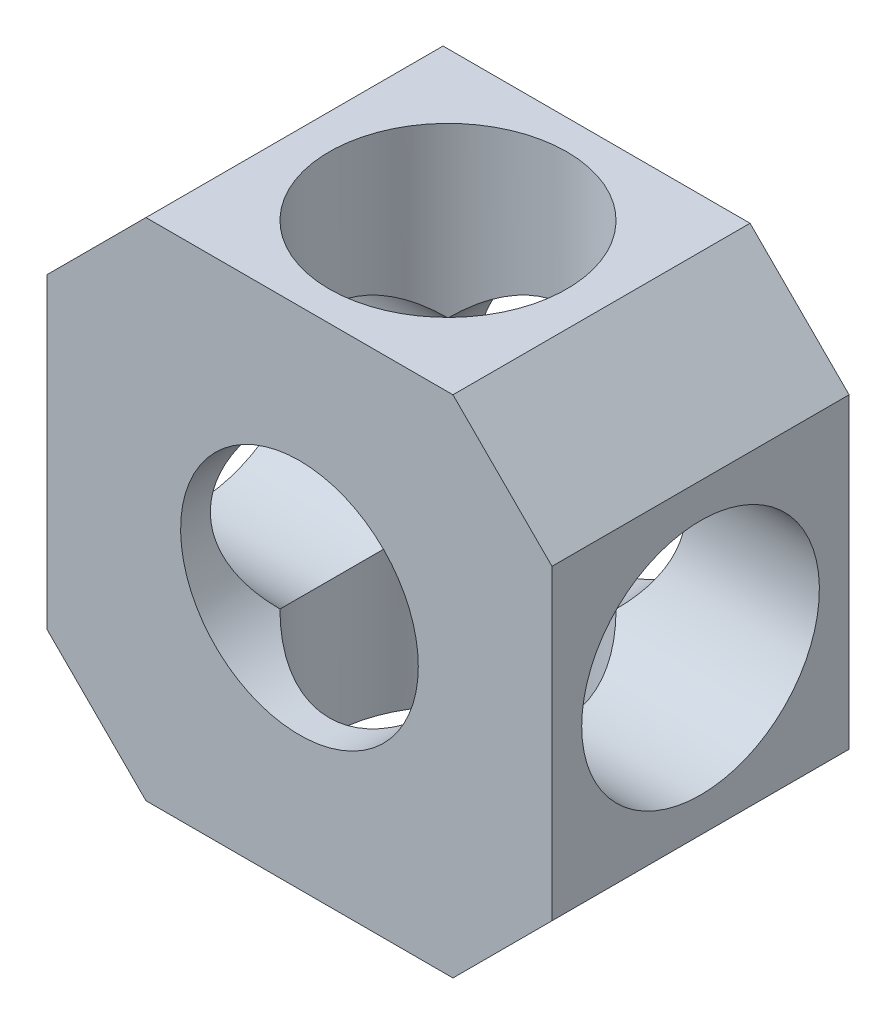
SolidWorks part; units mm, degrees
ref_plane "Front Plane" through (0, 0, 0) normal (0, 0, 1) x (1, 0, 0)
ref_plane "Top Plane" through (0, 0, 0) normal (0, 1, 0) x (1, 0, 0)
ref_plane "Right Plane" through (0, 0, 0) normal (1, 0, 0) x (0, 0, -1)
sketch "Sketch1" plane through (0, 0, 0) normal (0, 0, 1) x (1, 0, 0)
  line L0 (-12.75, 7.75) -> (-7.75, 12.75)
  line L1 (-7.75, 12.75) -> (7.75, 12.75)
  line L2 (-12.75, 7.75) -> (-12.75, -7.75)
  line L3 (-7.75, -12.75) -> (7.75, -12.75)
  line L4 (12.75, 7.75) -> (12.75, -7.75)
  line L5 (7.75, 12.75) -> (12.75, 7.75)
  line L6 (7.75, -12.75) -> (12.75, -7.75)
  line L7 (-12.75, -7.75) -> (-7.75, -12.75)
  circle A0 centre (0, 0) radius 6
  point P0 (-12.75, 12.75)
  point P1 (12.75, -12.75)
  point P2 (-12.75, -12.75)
  point P3 (12.75, 12.75)
  dimension "D3" = 12
  dimension "D1" = 25.5
  dimension "D2" = 25.5
extrude "Boss-Extrude1" add sketch "Sketch1" along normal mid plane 15
sketch "Sketch3" plane through (0, 12.75, 0) normal (0, 1, 0) x (1, 0, 0)
  circle A0 centre (0, 0) radius 6
  dimension "D1" = 12
extrude "Cut-Extrude1" cut sketch "Sketch3" against normal through all
pattern_circular "CirPattern1" count 4 over 360 about axis through (0, 0, 7.5) along (0, 0, -1) of "Cut-Extrude1"
scale "Scale1" scale about centroid uniform scaling yes scale factor 0.75
